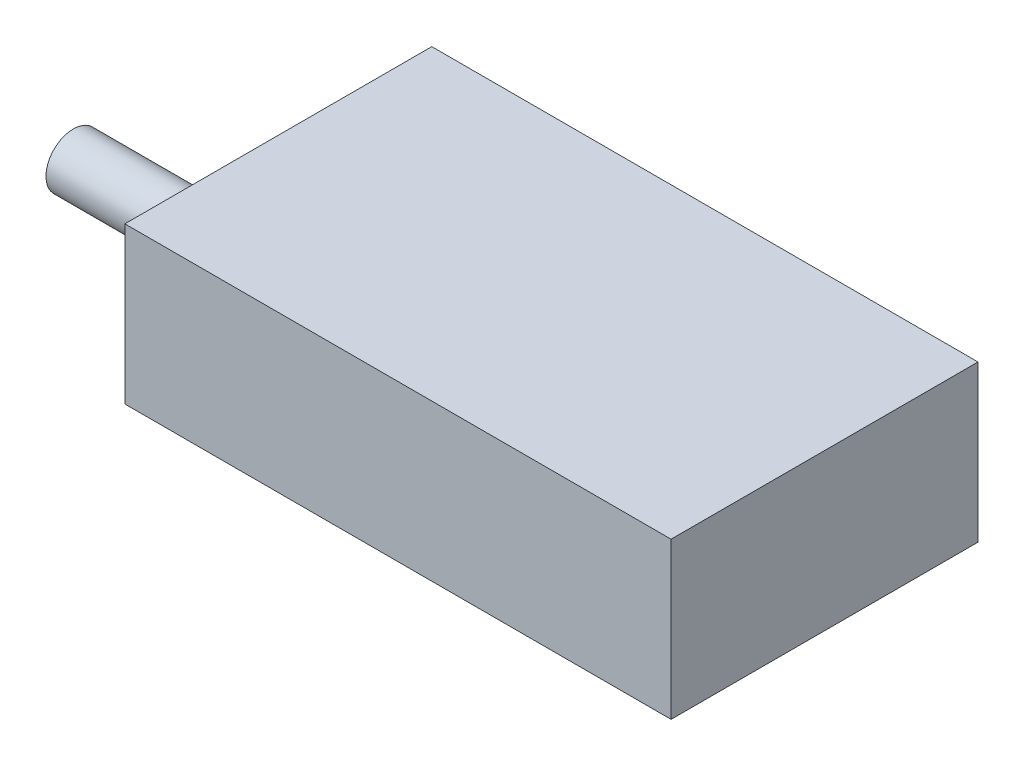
SolidWorks part; units mm, degrees
ref_plane "前视基准面" through (0, 0, 0) normal (0, 0, 1) x (1, 0, 0)
ref_plane "上视基准面" through (0, 0, 0) normal (0, 1, 0) x (1, 0, 0)
ref_plane "右视基准面" through (0, 0, 0) normal (1, 0, 0) x (0, 0, -1)
sketch "草图1" plane through (0, 0, 0) normal (0, 1, 0) x (1, 0, 0)
  line L1 (-26.8321, 16.5206) -> (78.1679, 16.5206)
  line L2 (-26.8321, 16.5206) -> (-26.8321, -42.4794)
  line L3 (-26.8321, -42.4794) -> (78.1679, -42.4794)
  line L4 (78.1679, 16.5206) -> (78.1679, -42.4794)
  dimension "D1" = 105
  dimension "D2" = 59
extrude "凸台-拉伸1" add sketch "草图1" along normal blind 30
sketch "草图2" plane through (-26.8321, 0, 0) normal (-1, 0, 0) x (0, 0, 1)
  line L0 (-16.5206, 30) -> (42.4794, 30) construction
  circle A1 centre (17.8903, 11) radius 5.25
  point P4 (17.8903, 11)
  dimension "D1" = 19
extrude "凸台-拉伸2" add sketch "草图2" along normal blind 34.5
